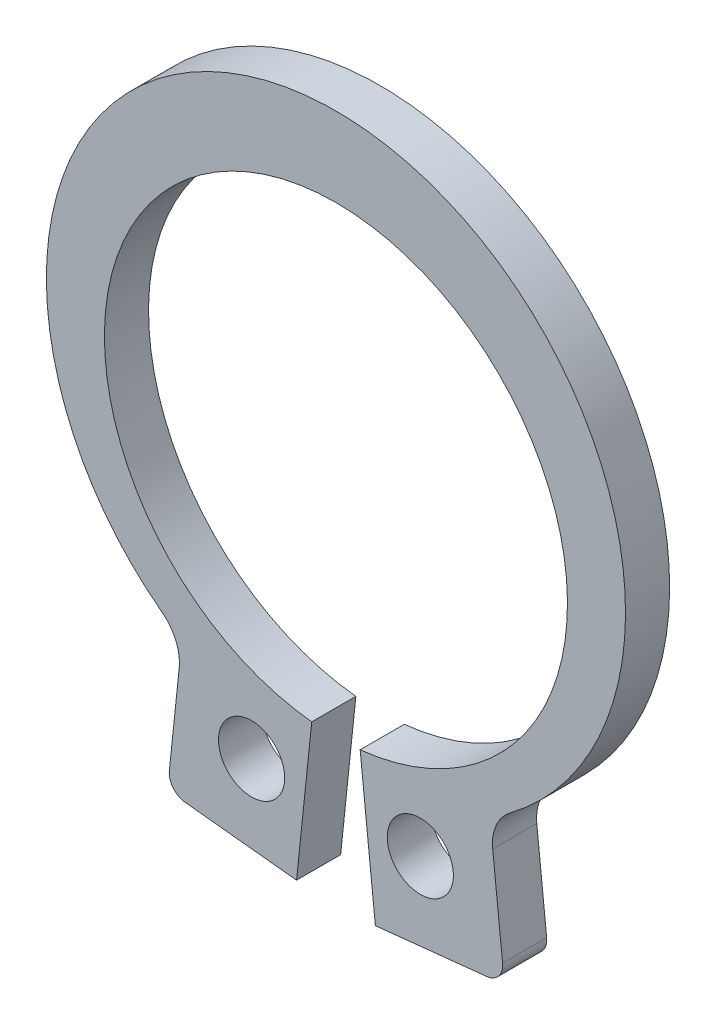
SolidWorks part; units mm, degrees
ref_plane "Face" through (0, 0, 0) normal (0, 0, 1) x (1, 0, 0)
ref_plane "Dessus" through (0, 0, 0) normal (0, 1, 0) x (1, 0, 0)
ref_plane "Droite" through (0, 0, 0) normal (1, 0, 0) x (0, 0, -1)
sketch "Esquisse1" plane through (0, 0, 0) normal (0, 0, 1) x (1, 0, 0)
  line L0 (-0.5488, -5.2212) -> (-0.8937, -8.5032)
  line L1 (-0.8937, -8.5032) -> (-3.4222, -8.2374)
  line L2 (-3.7782, -7.7978) -> (-3.5542, -5.6664)
  line L3 (3.5542, -5.6664) -> (3.7782, -7.7978)
  line L4 (3.4222, -8.2374) -> (0.8937, -8.5032)
  line L5 (0.8937, -8.5032) -> (0.5488, -5.2212)
  arc A0 (0.5488, -5.2212) -> (-0.5488, -5.2212) centre (0, 0) ccw
  arc A1 (-3.4222, -8.2374) -> (-3.7782, -7.7978) centre (-3.3804, -7.8396) cw
  arc A2 (-3.5542, -5.6664) -> (-3.9475, -4.7628) centre (-4.5487, -5.5618) ccw
  arc A3 (-3.9475, -4.7628) -> (3.9475, -4.7628) centre (0, 0.484) cw
  arc A4 (3.9475, -4.7628) -> (3.5542, -5.6664) centre (4.5487, -5.5618) ccw
  arc A5 (3.7782, -7.7978) -> (3.4222, -8.2374) centre (3.3804, -7.8396) cw
  dimension "D1" = 5.25
extrude "Base-Extrusion" add sketch "Esquisse1" along normal blind 1
sketch "Esquisse2" plane through (0, 0, 0) normal (0, 0, 1) x (1, 0, 0)
  arc A0 (2.663, -6.6295) -> (1.163, -6.6295) centre (1.913, -6.6295) cw
  arc A1 (1.163, -6.6295) -> (2.663, -6.6295) centre (1.913, -6.6295) cw
extrude "Enlèv. mat.-Extru.1" cut sketch "Esquisse2" along normal blind 1
sketch "Esquisse3" plane through (0, 0, 0) normal (0, 0, 1) x (1, 0, 0)
  arc A0 (-2.663, -6.6295) -> (-1.163, -6.6295) centre (-1.913, -6.6295) cw
  arc A1 (-1.163, -6.6295) -> (-2.663, -6.6295) centre (-1.913, -6.6295) cw
extrude "Enlèv. mat.-Extru.2" cut sketch "Esquisse3" along normal blind 1
